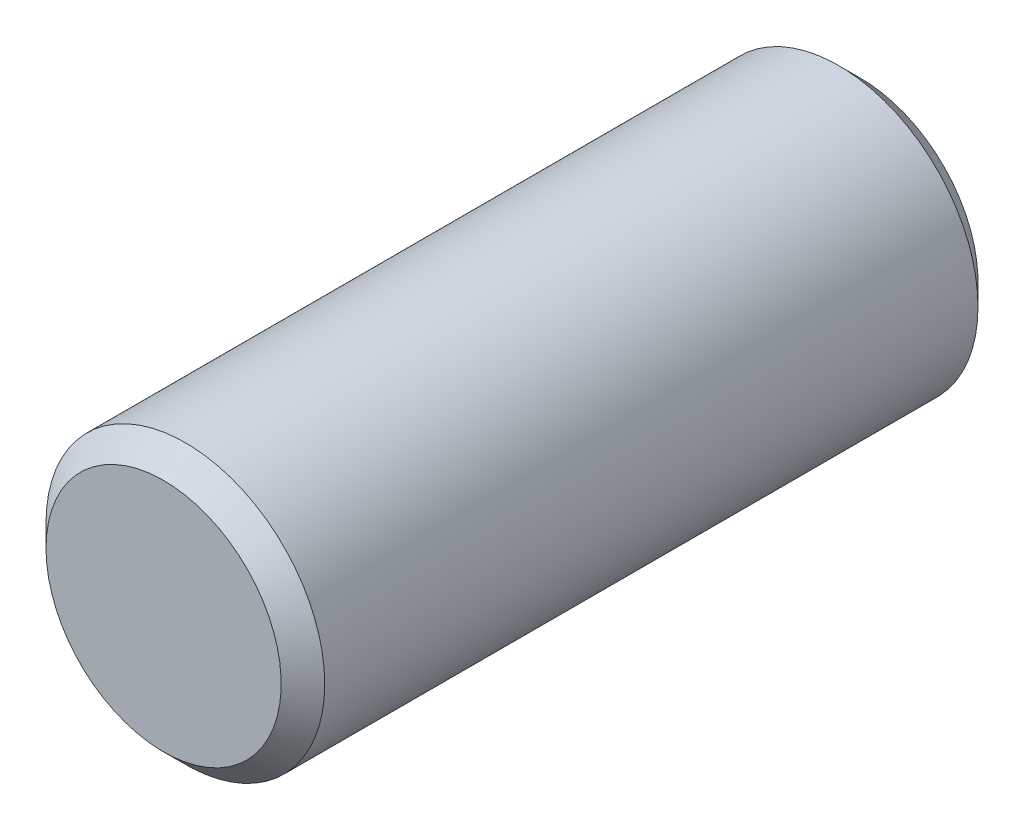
SolidWorks part; units mm, degrees
ref_plane "Plan1" through (0, 0, 0) normal (0, 0, 1) x (1, 0, 0)
ref_plane "Plan2" through (0, 0, 0) normal (0, 1, 0) x (1, 0, 0)
ref_plane "Plan3" through (0, 0, 0) normal (1, 0, 0) x (0, 0, -1)
sketch "E_corps" plane through (0, 0, 0) normal (0, 1, 0) x (1, 0, 0)
  line L0 (0, 0) -> (3.375, 0)
  line L1 (3.375, 0) -> (4, -0.625)
  line L2 (4, -0.625) -> (4, -19.375)
  line L3 (4, -19.375) -> (3.375, -20)
  line L4 (3.375, -20) -> (0, -20)
  line L5 (0, -20) -> (0, 0)
  line L6 (0, 10) -> (0, -120) construction
  dimension "D1" = 45
  dimension "D3" = 45
  dimension "Longueur" = 20
  dimension "Diamètre_nominal" = 8
  dimension "Chanfrein" = 0.625
revolve "Corps" add sketch "E_corps" angle 360 about L6
sketch "E_empreinte" plane through (0, 0, 0) normal (0, 0, -1) x (-1, 0, 0)
  line L0 (0, 31.3594) -> (0, -33.6716) construction
  line L1 (0, 2.29) -> (-1.9832, 1.145)
  line L2 (-1.9832, 1.145) -> (-1.9832, -1.145)
  line L3 (-1.9832, -1.145) -> (0, -2.29)
  line L4 (1.9832, -1.145) -> (0, -2.29)
  line L5 (1.9832, 1.145) -> (1.9832, -1.145)
  line L6 (0, 2.29) -> (1.9832, 1.145)
  circle A0 centre (0, 0) radius 2.29 construction
  dimension "Diamètre" = 4.58
extrude "Empreinte" cut sketch "E_empreinte" against normal blind 4.5
sketch "Esquisse3" plane through (0, 0, 4.5) normal (0, 0, -1) x (-1, 0, 0)
  line L6 (1.9832, 1.145) -> (0, 2.29)
  line L7 (0, 2.29) -> (-1.9832, 1.145)
  line L8 (-1.9832, 1.145) -> (-1.9832, -1.145)
  line L9 (-1.9832, -1.145) -> (0, -2.29)
  line L10 (0, -2.29) -> (1.9832, -1.145)
  line L11 (1.9832, -1.145) -> (1.9832, 1.145)
  line L12 (1.9832, 1.145) -> (0, 2.29)
  line L13 (0, 2.29) -> (-1.9832, 1.145)
  line L14 (-1.9832, 1.145) -> (-1.9832, -1.145)
  line L15 (-1.9832, -1.145) -> (0, -2.29)
  line L16 (0, -2.29) -> (1.9832, -1.145)
  line L17 (1.9832, -1.145) -> (1.9832, 1.145)
  dimension "D1" = 0
ref_plane "Profondeur_de_l'empreinte" through (0, 0, 5) normal (0, 0, -1) x (-1, 0, 0)
sketch "Esquisse4" plane through (0, 0, 5) normal (0, 0, -1) x (-1, 0, 0)
  point P0 (0, 0)
loft "Fond_de_l'empreinte" cut profiles "Esquisse4", "Esquisse3"
equation "\"D1@Empreinte\" = 0.9*\"Prof@Profondeur_de_l'empreinte\""
